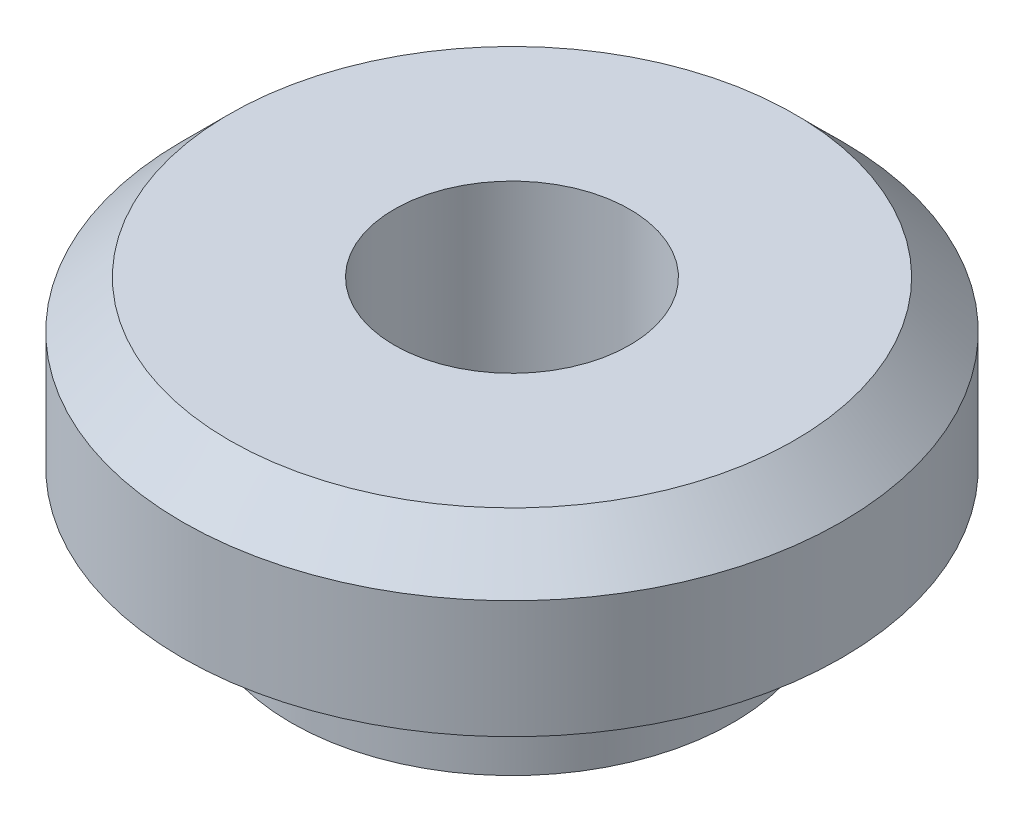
SolidWorks part; units mm, degrees
ref_plane "Front" through (0, 0, 0) normal (0, 0, 1) x (1, 0, 0)
ref_plane "Top" through (0, 0, 0) normal (0, 1, 0) x (1, 0, 0)
ref_plane "Side" through (0, 0, 0) normal (1, 0, 0) x (0, 0, -1)
sketch "Sketch1" plane through (0, 0, 0) normal (1, 0, 0) x (0, 0, -1)
  line L0 (0, 40) -> (0, -40) construction
  line L1 (-1.27, 1.778) -> (-1.27, -1.1938)
  line L2 (-1.27, 1.778) -> (-3.048, 1.778)
  line L3 (-3.048, 1.778) -> (-3.556, 1.27)
  line L4 (-3.556, 1.27) -> (-3.556, 0)
  line L5 (-3.556, 0) -> (-2.3812, 0)
  line L6 (-2.3812, 0) -> (-2.3812, -1.1938)
  line L7 (-2.3812, -1.1938) -> (-1.27, -1.1938)
  dimension "D1" = 1.778
  dimension "D2" = 2.9718
  dimension "D3" = 1.27
  dimension "D4" = 2.3812
  dimension "D5" = 3.556
  dimension "D6" = 0.508
  dimension "D7" = 0.508
  dimension "D8" = 1.1748
revolve "Boss-Revolve1" add sketch "Sketch1" angle 360 about L0
